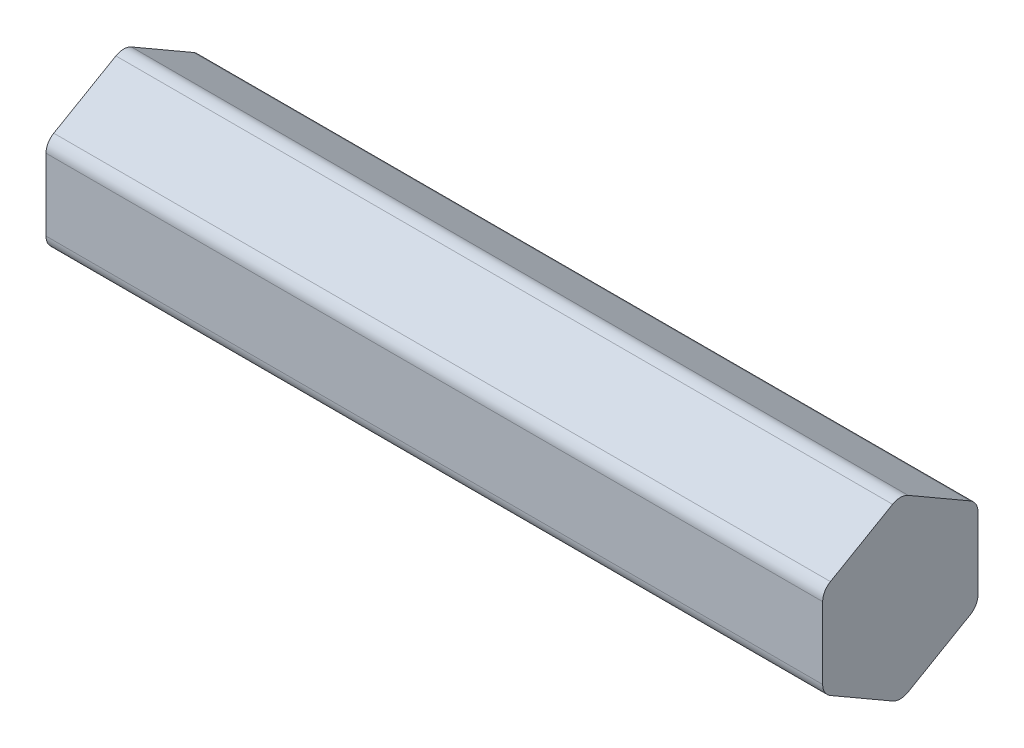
SolidWorks part; units mm, degrees
ref_plane "Front" through (0, 0, 0) normal (0, 0, 1) x (1, 0, 0)
ref_plane "Top" through (0, 0, 0) normal (0, 1, 0) x (1, 0, 0)
ref_plane "Right" through (0, 0, 0) normal (1, 0, 0) x (0, 0, -1)
other "Configuration Table"
sketch "Sketch1" plane through (0, 0, 0) normal (1, 0, 0) x (0, 0, -1)
  line L1 (0, 5.7735) -> (-5, 2.8868)
  line L2 (-5, 2.8868) -> (-5, -2.8868)
  line L3 (-5, -2.8868) -> (0, -5.7735)
  line L4 (0, -5.7735) -> (5, -2.8868)
  line L5 (5, -2.8868) -> (5, 2.8868)
  line L6 (5, 2.8868) -> (0, 5.7735)
  circle A0 centre (0, 0) radius 5 construction
  dimension "s" = 10
extrude "Base" add sketch "Sketch1" along normal blind 50
fillet "Fillet1" radius 1 6 edges at (25, 2.8868, -5) (25, -2.8868, -5) (25, -5.7735, 0) (25, -2.8868, 5) (25, 2.8868, 5) (25, 5.7735, 0)
